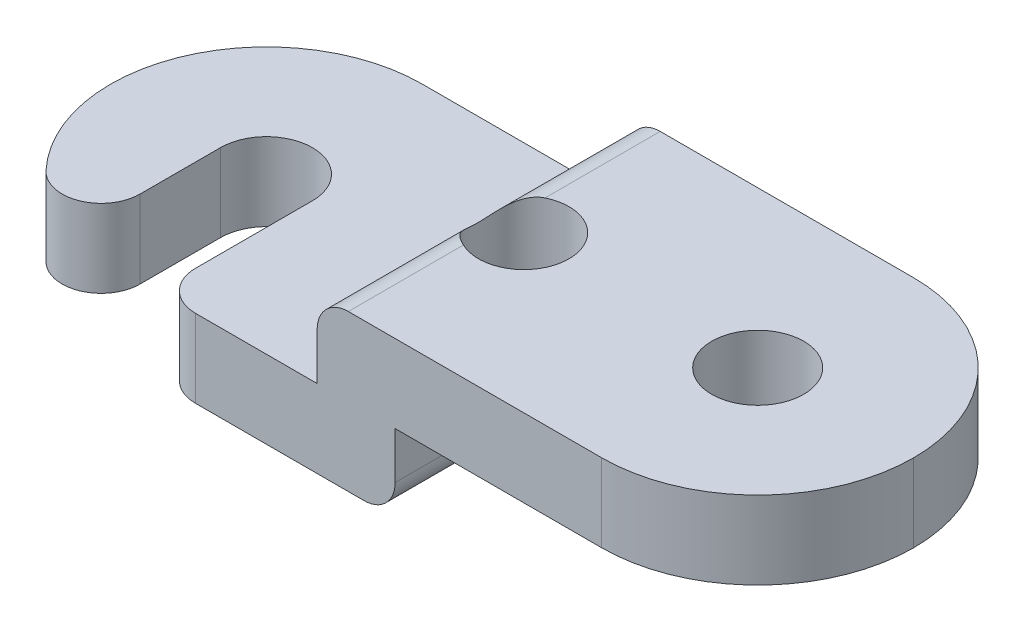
SolidWorks part; units mm, degrees
ref_plane "Front Plane" through (0, 0, 0) normal (0, 0, 1) x (1, 0, 0)
ref_plane "Top Plane" through (0, 0, 0) normal (0, 1, 0) x (1, 0, 0)
ref_plane "Right Plane" through (0, 0, 0) normal (1, 0, 0) x (0, 0, -1)
sketch "Sketch1" plane through (0, 0, 0) normal (0, 1, 0) x (1, 0, 0)
  line L1 (5.15, -2) -> (-5.15, -2)
  line L2 (5.15, -2) -> (5.15, 2)
  line L3 (5.15, 2) -> (-5.15, 2)
  line L4 (-5.15, -2) -> (-5.15, 2)
  line L5 (5.15, -2) -> (-5.15, 2) construction
  line L6 (5.15, 2) -> (-5.15, -2) construction
  point P0 (0, 0)
  dimension "D1" = 4
  dimension "D2" = 10.3
extrude "Boss-Extrude1" add sketch "Sketch1" along normal blind 2
fillet "Fillet1" radius 2 2 edges at (5.15, 1, -2) (5.15, 1, 2)
fillet "Fillet2" radius 2 2 edges at (-5.15, 1, -2) (-5.15, 1, 2)
sketch "Sketch2" plane through (0, 2, 0) normal (0, 1, 0) x (1, 0, 0)
  line L1 (3.15, 2) -> (-3.15, 2) construction
  line L3 (-0.5, -2) -> (-3.15, -2)
  line L4 (-3.15, 2) -> (-0.5, 2)
  line L5 (-0.5, 2) -> (-0.5, -2)
  arc A0 (-3.15, -2) -> (-3.15, 2) centre (-3.15, 0) cw
extrude "Cut-Extrude1" cut sketch "Sketch2" against normal blind 1
sketch "Sketch3" plane through (0, 0, 0) normal (0, -1, 0) x (1, 0, 0)
  line L0 (0.5, 2) -> (0.5, -2)
  line L1 (-3.15, 2) -> (3.15, 2) construction
  line L2 (3.15, -2) -> (-3.15, -2) construction
  line L3 (0.5, -2) -> (3.15, -2)
  line L4 (3.15, 2) -> (0.5, 2)
  line L5 (-0.5, 2) -> (-0.5, -2) construction
  arc A0 (3.15, -2) -> (3.15, 2) centre (3.15, 0) ccw
  dimension "D1" = 1
extrude "Cut-Extrude2" cut sketch "Sketch3" against normal blind 1
fillet "Fillet3" radius 0.4 2 edges at (-0.5, 2, 0) (0.5, 0, 0)
sketch "Sketch4" plane through (0, 1, 0) normal (0, -1, 0) x (1, 0, 0)
  circle A0 centre (-3.15, 0) radius 0.59
  arc A1 (-3.15, 2) -> (-5.15, 0) centre (-3.15, 0) ccw construction
  dimension "D1" = 1.18
extrude "Cut-Extrude5" cut sketch "Sketch4" against normal mid plane 21
sketch "Sketch5" plane through (0, 1, 0) normal (0, -1, 0) x (1, 0, 0)
  circle A0 centre (3.15, 0) radius 0.59
  dimension "D1" = 1.18
extrude "Cut-Extrude6" cut sketch "Sketch5" against normal through all
sketch "Sketch6" plane through (0, 0, 0) normal (0, -1, 0) x (1, 0, 0)
  line L0 (-3.74, 0) -> (-3.74, 1.911)
  line L1 (-2.56, 0) -> (-2.56, 2)
  line L2 (-3.15, 2) -> (0.1, 2) construction
  line L3 (-2.56, 2) -> (-3.15, 2)
  circle A0 centre (-3.15, 0) radius 0.59 construction
  arc A1 (-3.15, 2) -> (-5.15, 0) centre (-3.15, 0) ccw construction
  arc A2 (-3.15, 2) -> (-3.74, 1.911) centre (-3.15, 0) ccw
extrude "Cut-Extrude7" cut sketch "Sketch6" against normal through all and the other way through all
fillet "Fillet4" radius 0.5 2 edges at (-3.74, 0.5, 1.911) (-2.56, 0.5, 2)
sketch "Sketch7" plane through (0, 1, 0) normal (0, -1, 0) x (1, 0, 0)
  circle A0 centre (0.15, 0) radius 0.58
  circle A1 centre (3.15, 0) radius 0.59 construction
  dimension "D1" = 1.16
  dimension "D2" = 3
extrude "Cut-Extrude8" cut sketch "Sketch7" against normal blind 21
